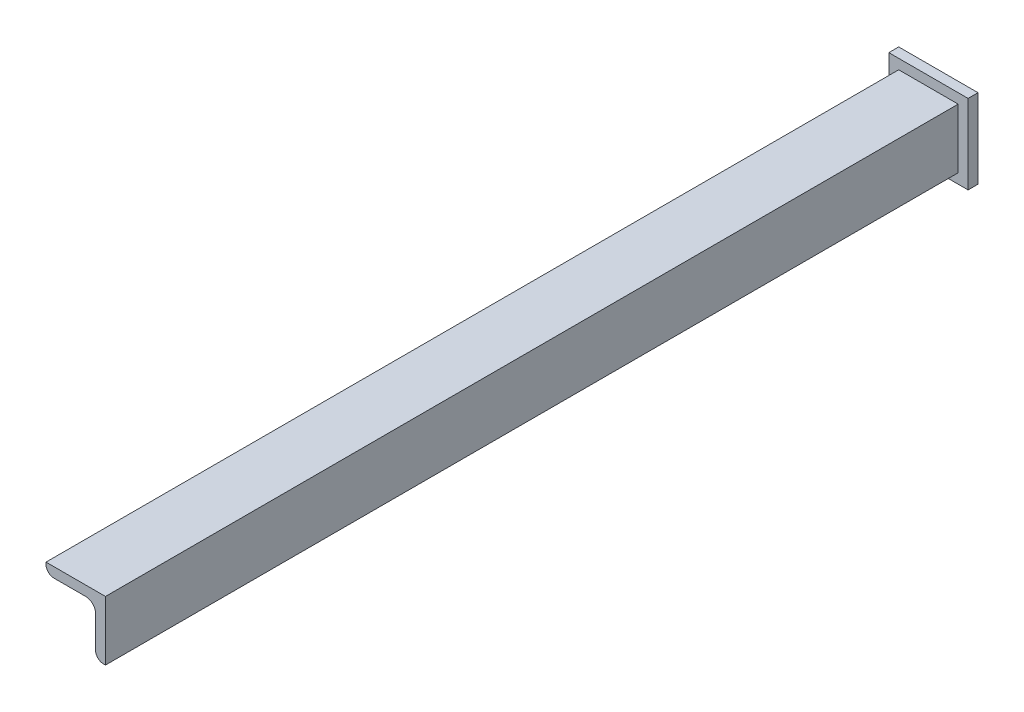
SolidWorks part; units mm, degrees
ref_plane "Plan de face" through (0, 0, 0) normal (0, 0, 1) x (1, 0, 0)
ref_plane "Plan de dessus" through (0, 0, 0) normal (0, 1, 0) x (1, 0, 0)
ref_plane "Plan de droite" through (0, 0, 0) normal (1, 0, 0) x (0, 0, -1)
sketch "Esquisse22" plane through (0, 0, 0) normal (0, 0, -1) x (-1, 0, 0)
  line L4 (-3032.0001, 0) -> (-3032.0001, -80)
  line L5 (-3032.0001, -80) -> (-2951.9999, -80)
  line L6 (-2951.9999, -80) -> (-2951.9999, 0)
  line L7 (-2951.9999, 0) -> (-3032.0001, 0)
extrude "Boss.-Extru.1" add sketch "Esquisse22" against normal blind 10
sketch "Esquisse23" plane through (0, 0, 10) normal (0, 0, 1) x (1, 0, 0)
  line L6 (2961.9999, -10) -> (3022.002, -9.999)
  line L7 (2961.9999, -20) -> (2961.9999, -10)
  line L8 (3012.0001, -70) -> (3012.0001, -20.005)
  line L9 (3022.0001, -70) -> (3012.0001, -70)
  line L10 (3022.002, -9.999) -> (3022.0001, -70)
  line L11 (3012.0001, -20.005) -> (2961.9999, -20)
extrude "Boss.-Extru.2" add sketch "Esquisse23" along normal blind 860.31
sketch "Esquisse24" plane through (0, 0, 10) normal (0, 0, 1) x (1, 0, 0)
  line L0 (2951.9999, -80) -> (3032.0001, 0) construction
  line L1 (3032.0001, 0) -> (2951.9999, 0) construction
  line L2 (2951.9999, 0) -> (3032.0001, -80) construction
  circle A0 centre (2981.8937, -50.1062) radius 7.5
  point P10 (2992, -40)
  point P11 (2981.8937, -50.1062)
  dimension "D1" = 15
extrude "Enlèv. mat.-Extru.1" cut sketch "Esquisse24" against normal blind 10
fillet "Congé1" radius 10 1 edges at (3012.0001, -20.005, 440.155)
fillet "Congé2" radius 8 2 edges at (3012.0001, -70, 440.155) (2961.9999, -20, 440.155)
